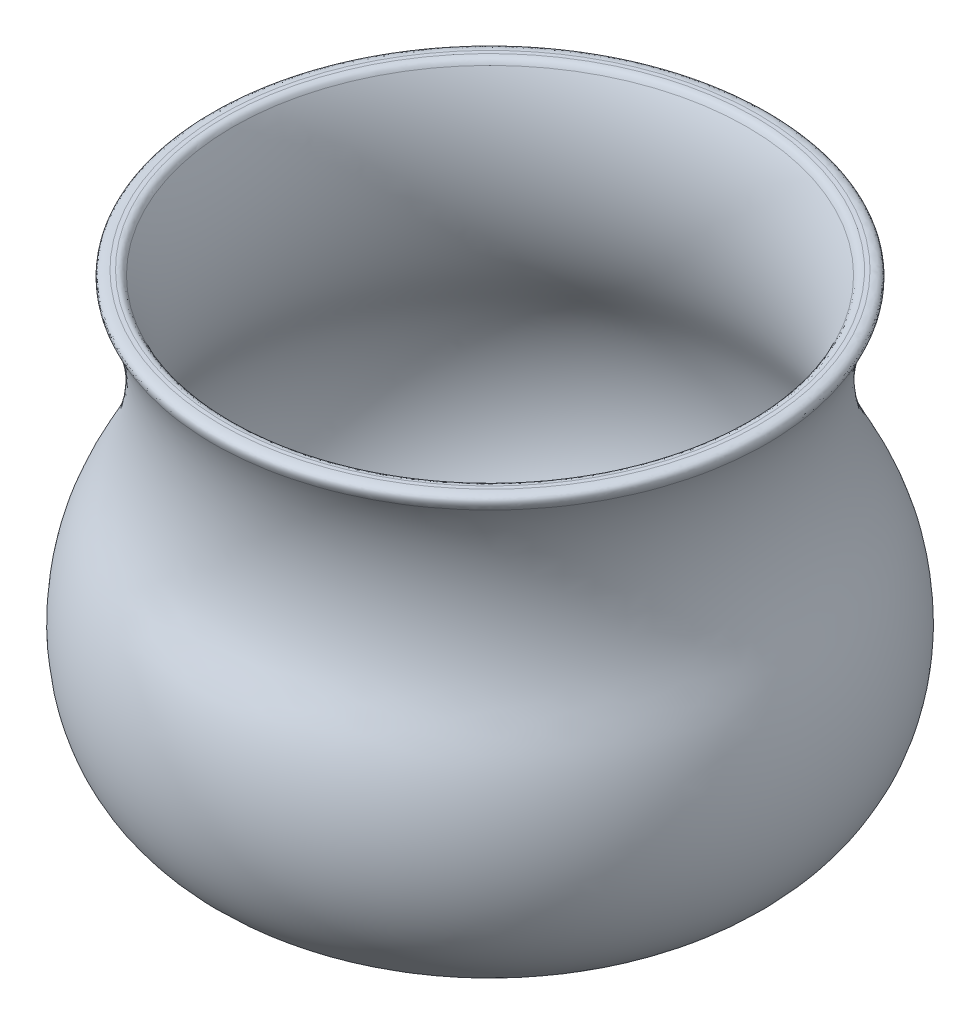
SolidWorks part; units mm, degrees
ref_plane "Alzado" through (0, 0, 0) normal (0, 0, 1) x (1, 0, 0)
ref_plane "Planta" through (0, 0, 0) normal (0, 1, 0) x (1, 0, 0)
ref_plane "Vista lateral" through (0, 0, 0) normal (1, 0, 0) x (0, 0, -1)
sketch "Croquis2" plane through (0, 0, 0) normal (0, 0, 1) x (1, 0, 0)
  line L0 (-2.5989, 6.0908) -> (-2.5989, 156.0908) construction
  line L1 (-53.8006, 11.7798) -> (53.8006, 11.7798) construction
  line L2 (-2.5989, 11.7798) -> (-2.5989, 17.7798)
  line L4 (-84.4432, 135.1378) -> (-77.459, 135.1378)
  spline S0 degree 3 poles (-2.5989, 11.7798) (-21.937, 11.7798) (-38.6971, 0.0087) (-92.9541, 8.3239) (-99.1032, 54.623) (-74.4516, 94.7755) (-75.1955, 121.0015) (-84.4432, 135.1378) knots 0.028628 0.028628 0.028628 0.028628 0.221756 0.290563 0.66935 0.745028 1 1 1 1
  spline S1 degree 1 poles (-2.5989, 17.7798) (-79.4221, 138.4225) knots 0 0 1 1 construction
  spline S2 degree 3 poles (-2.5989, 17.7798) (-3.418, 17.7798) (-5.0723, 17.7505) (-8.2501, 17.5838) (-12.0716, 17.1898) (-16.4008, 16.4787) (-21.863, 15.2934) (-28.1523, 13.5199) (-35.0224, 11.388) (-41.4079, 9.6557) (-46.5126, 8.806) (-50.6039, 8.6086) (-54.8803, 8.7616) (-59.2432, 9.4213) (-63.3201, 10.5165) (-67.0748, 11.8603) (-71.225, 13.987) (-75.4333, 17.1655) (-80.1261, 22.1688) (-84.3964, 29.7617) (-87.032, 40.4876) (-87.1538, 50.0817) (-86.0732, 57.6817) (-84.6989, 63.2297) (-83.1207, 67.6139) (-81.5978, 70.9528) (-79.8635, 74.4014) (-77.9361, 78.0277) (-76.0509, 82.0155) (-74.3305, 86.2588) (-72.6473, 91.7261) (-70.8921, 100.791) (-70.4969, 112.4274) (-72.608, 123.8527) (-75.9247, 132.4467) (-78.1619, 136.4961) (-79.4221, 138.4225) knots 0.028628 0.028628 0.028628 0.028628 0.036217 0.043806 0.058983 0.074161 0.089339 0.119694 0.150049 0.180405 0.21076 0.225938 0.241116 0.271471 0.286649 0.301826 0.332182 0.362537 0.392892 0.453603 0.514314 0.575025 0.60538 0.635735 0.666091 0.681269 0.696446 0.726802 0.741979 0.757157 0.787512 0.817868 0.878578 0.939289 0.969645 1 1 1 1 only from (-2.5989, 17.7798) to (-77.459, 135.1378)
  point P4 (0, 0)
  point P7 (-89.3169, 58.8211)
  point P9 (-67.2963, 106.3576)
  point P10 (-78.1318, 146.2043)
  point P11 (0, 0)
  point P12 (-92.8122, 56.7239)
  point P13 (-81.7907, 144.0686)
  point P16 (-88.1732, 58.4856)
  point P18 (-87.3029, 56.1647)
  point P19 (-88.7534, 57.6733)
  point P20 (-90.4146, 46.3692)
  point P21 (-99.0009, 40.1273)
  point P22 (0, 0)
  point P23 (-99.0009, 46.0514)
  point P25 (-77.6742, 10.2699)
  point P26 (0, 0)
  point P27 (-76.7263, 6.0908)
  point P28 (0, 0)
  point P29 (-84.6395, 98.6668)
  point P30 (-79.4533, 93.3898)
  point P31 (-82.4862, 105.53)
  point P32 (-60.596, 6.0908)
  point P33 (-72.7357, 104.762)
  point P34 (-83.6383, 150.4625)
  point P35 (-74.6863, 99.797)
  point P36 (-61.559, 10.7081)
  point P37 (-0.1264, 19.4445)
  point P38 (-48.7093, 1.5946)
  point P39 (-2.5989, 11.7798)
  point P40 (-86.3103, 75.9634)
  point P41 (-80.5271, 140.0685)
  point P42 (-83.2294, 139.3647)
  point P43 (0, 0)
  point P44 (-84.7017, 76.5009)
  point P45 (0, 0)
  point P46 (-85.4662, 75.1187)
  point P47 (-54.7746, 2.8229)
  point P48 (-83.7611, 79.8929)
  point P49 (-84.4432, 135.1378)
  dimension "D2" = 6
  dimension "D1" = 150
revolve "Revolución1" add sketch "Croquis2" angle 360 about L2
fillet "Redondeo1" radius 2.5 2 edges at (-2.5989, 135.1378, -74.8601) (-2.5989, 135.1378, -81.8443)
